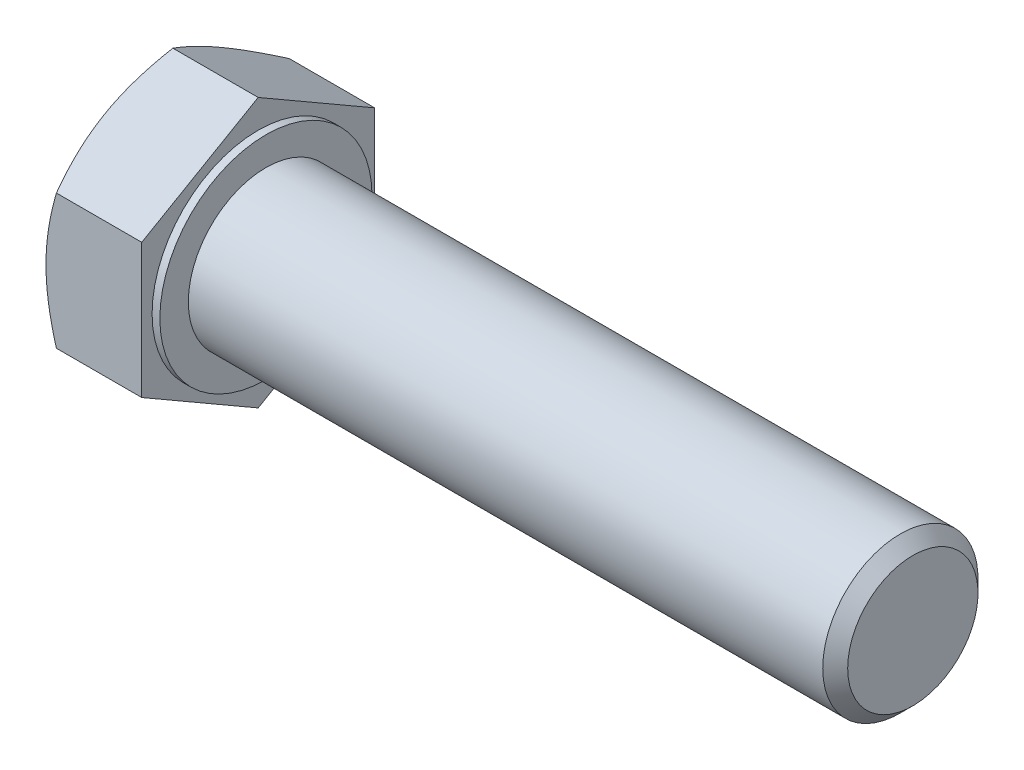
SolidWorks part; units mm, degrees
extrude "BaseHead" add sketch "HeadSke" along normal blind 8
sketch "HeadSke" plane through (0, 0, 0) normal (1, 0, 0) x (0, 0, -1)
  line L0 (9, 5.1962) -> (9, -5.1962)
  line L1 (-9, 5.1962) -> (-9, -5.1962)
  line L2 (9, -5.1962) -> (0, -10.3923)
  line L3 (0, -10.3923) -> (-9, -5.1962)
  line L4 (9, 5.1962) -> (0, 10.3923)
  line L5 (0, 10.3923) -> (-9, 5.1962)
  line L6 (0, 10.3923) -> (0, -10.3923) construction
  dimension "Width_flats" = 18
  dimension "D2" = 120
ref_plane "Plane1" through (0, 0, 0) normal (0, 0, 1) x (1, 0, 0)
ref_plane "Plane2" through (0, 0, 0) normal (0, 1, 0) x (1, 0, 0)
ref_plane "Plane3" through (0, 0, 0) normal (1, 0, 0) x (0, 0, -1)
sketch "BodySke" plane through (0, 0, 0) normal (0, 0, 1) x (1, 0, 0)
  line L0 (0, 5.1962) -> (0, -5.1962) construction
  line L1 (0, 0) -> (58, 0)
  line L2 (0, 0) -> (0, 6)
  line L3 (0, 6) -> (57.036, 6)
  line L4 (58, 0) -> (58, 5.036)
  line L5 (8, 10.3923) -> (8, 5.1962) construction
  line L6 (58, 5.036) -> (57.036, 6)
  line L7 (0, 0) -> (96.52, 0) construction
  line L8 (58, -5.036) -> (57.036, -6) construction
  line L9 (0, -6) -> (57.036, -6) construction
  line L10 (9.75, 15.24) -> (9.75, -1.27) construction
  line L11 (40.25, 6.8002) -> (40.25, -5.502) construction
  line L12 (8, 5.1962) -> (8, -5.1962) construction
revolve "BaseBody" add sketch "BodySke"
fillet "HeadFillet" [suppressed] radius 0.6
sketch "Sketch3" plane through (0, 0, 0) normal (0, 1, 0) x (1, 0, 0)
  line L0 (2.25, 12.8971) -> (-2.25, 5.1029)
  line L1 (2.25, 12.8971) -> (-9.8048, 19.8569)
  line L2 (-2.25, 5.1029) -> (-14.3048, 12.0627)
  line L3 (-9.8048, 19.8569) -> (-14.3048, 12.0627)
  line L4 (0, 9) -> (0, 0) construction
  line L6 (0, 0) -> (99.06, 0) construction
  dimension "D1" = 13.9196
  dimension "Head_ch_ang" = 30
revolve "HeadChamfer" cut sketch "Sketch3" angle 360 about L6
sketch "BearingSke" plane through (0, 0, 0) normal (0, 0, 1) x (1, 0, 0)
  line L0 (8, 10.3923) -> (0.8038, 10.3923) construction
  line L1 (8, 10.3923) -> (8, 5.1962) construction
  line L2 (8, 8.2) -> (7.4, 8.2)
  line L3 (8, 8.2) -> (8, 10.3923)
  line L4 (8, 10.3923) -> (7.4, 10.3923)
  line L5 (0, 0) -> (95.25, 0) construction
  line L6 (0, 0) -> (96.52, 0) construction
  line L7 (7.4, 8.2) -> (7.4, 10.3923)
  dimension "Bearing_ht" = 0.6
  dimension "Bearing_dia" = 16.4
revolve "BearingFace" cut sketch "BearingSke" angle 360 about L5
sketch "ThdSchSke" plane through (0, 0, 0) normal (0, 0, 1) x (1, 0, 0)
  line L0 (40.25, -5.036) -> (39.575, -6)
  line L1 (40.25, -5.036) -> (40.925, -6)
  line L2 (40.925, -6) -> (40.925, -7.5)
  line L3 (-3.175, 0) -> (5.1513, 0) construction
  line L5 (40.925, -7.5) -> (39.575, -7.5)
  line L6 (39.575, -7.5) -> (39.575, -6)
revolve "ThreadSchematic" [suppressed] cut sketch "ThdSchSke" angle 360 about L3
pattern_linear "ThdSchPat" [suppressed]
equation "\"Thread_minor@ThreadCosmetic\" = \"Minor_dia@BodySke\""
equation "\"Thread_length@ThreadCosmetic\" = ((sgn( (\"Length@BodySke\" - \"Advance@BodySke\" * 2.0 ) - \"Thread_nom@BodySke\" )-1)*( (\"Length@BodySke\" - \"Advance@BodySke\" * 2.0 ) - \"Thread_nom@BodySke\" ))/-2+ \"Thread_"
equation "\"Thread_minor@ThdSchSke\" = \"Minor_dia@BodySke\""
equation "\"Diameter@ThdSchSke\" = \"Diameter@BodySke\""
equation "\"Overcut@ThdSchSke\" = \"Diameter@BodySke\" * 1.25"
equation "\"Start@ThdSchSke\" = \"Head_ht@BaseHead\" + \"Length@BodySke\" - \"Thread_length@ThreadCosmetic\"  '---Non-countersunk---"
equation "\"Num_threads@ThdSchPat\" = int( \"Thread_length@ThreadCosmetic\" / \"Advance@BodySke\" + 0.999 )  + 1"
equation "\"Advance@ThdSchPat\" = \"Thread_length@ThreadCosmetic\" /  (\"Num_threads@ThdSchPat\" - 1) 'relax it"
equation "\"Num_threads@ThdSchPat\" = \"Num_threads@ThdSchPat\" - sgn( \"Num_threads@ThdSchPat\" - 1) '---chamfered tips only---"
